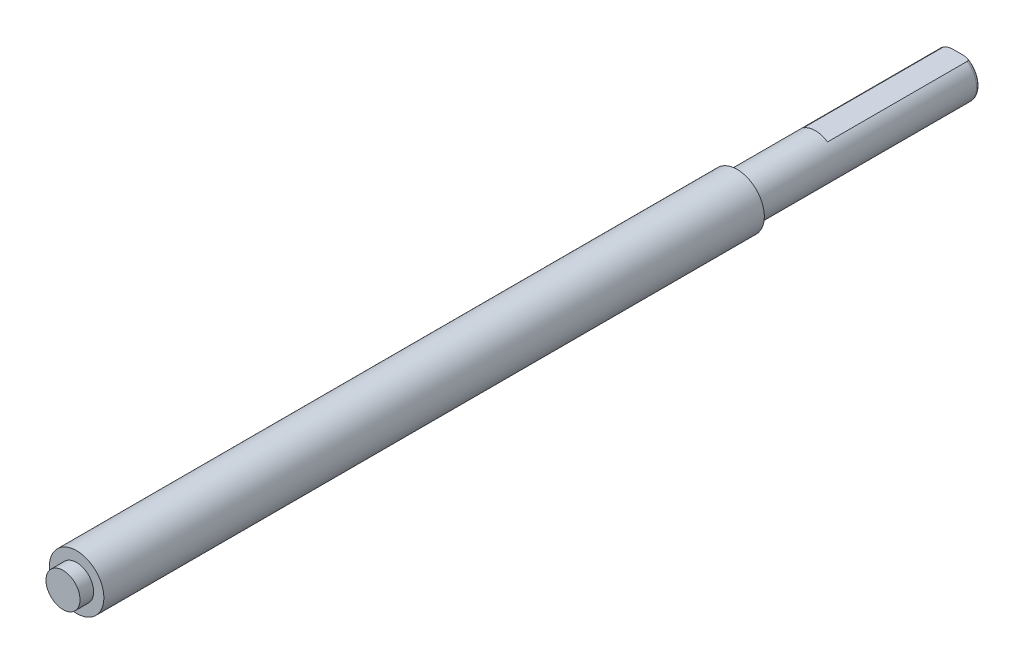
SolidWorks part; units mm, degrees
ref_plane "前视" through (0, 0, 0) normal (0, 0, 1) x (1, 0, 0)
ref_plane "上视" through (0, 0, 0) normal (0, 1, 0) x (1, 0, 0)
ref_plane "右视" through (0, 0, 0) normal (1, 0, 0) x (0, 0, -1)
sketch "草图2" plane through (0, 0, 0) normal (0, 0, 1) x (1, 0, 0)
  circle A0 centre (0, 0) radius 3.175
extrude "凸台-拉伸1" add sketch "草图2" along normal blind 32.5
sketch "草图3" plane through (0, 0, 32.5) normal (0, 0, 1) x (1, 0, 0)
  circle A0 centre (0, 0) radius 4
extrude "凸台-拉伸2" add sketch "草图3" along normal blind 97
sketch "草图4" plane through (0, 0, 0) normal (0, 0, -1) x (-1, 0, 0)
  line L0 (-1.7861, 2.625) -> (1.7861, 2.625)
  arc A0 (1.7861, 2.625) -> (-1.7861, 2.625) centre (0, 0) ccw
extrude "切除-拉伸1" cut sketch "草图4" against normal blind 21
fillet "圆角1" radius 0.5 1 edges at (0, -3.175, 0)
sketch "草图5" plane through (0, 0, 129.5) normal (0, 0, 1) x (1, 0, 0)
  circle A0 centre (0, 0) radius 2.5
extrude "凸台-拉伸3" add sketch "草图5" along normal blind 2
